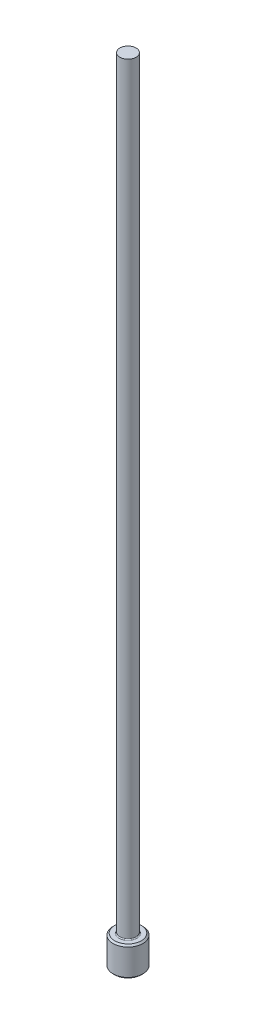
SolidWorks part; units mm, degrees
ref_plane "Front Plane" through (0, 0, 0) normal (0, 0, 1) x (1, 0, 0)
ref_plane "Top Plane" through (0, 0, 0) normal (0, 1, 0) x (1, 0, 0)
ref_plane "Right Plane" through (0, 0, 0) normal (1, 0, 0) x (0, 0, -1)
other "Configuration Table"
sketch "Sketch1" plane through (0, 0, 0) normal (0, 0, 1) x (1, 0, 0)
  line L0 (0, 259.9588) -> (0, -15.1925) construction
  line L1 (0, 0) -> (-1.1938, 0)
  line L2 (-1.1938, 0) -> (-1.1938, 2.3622)
  line L3 (-1.1938, 2.3622) -> (-0.6477, 2.3622)
  line L4 (-0.6477, 2.3622) -> (-0.6477, 63.5)
  line L5 (-0.6477, 63.5) -> (0, 63.5)
  line L6 (0, 63.5) -> (0, 0)
  dimension "L" = 63.5
  dimension "H" = 2.3876
  dimension "T" = 2.3622
  dimension "D" = 1.2954
revolve "Revolve1" add sketch "Sketch1" angle 360 about L0
chamfer "Chamfer1" distance 0.127 angle 45 2 edges at (0, 2.3622, 1.1938) (0, 0, 1.1938)
fillet "Fillet1" radius 0.0762 1 edges at (0, 2.3622, 0.6477)
